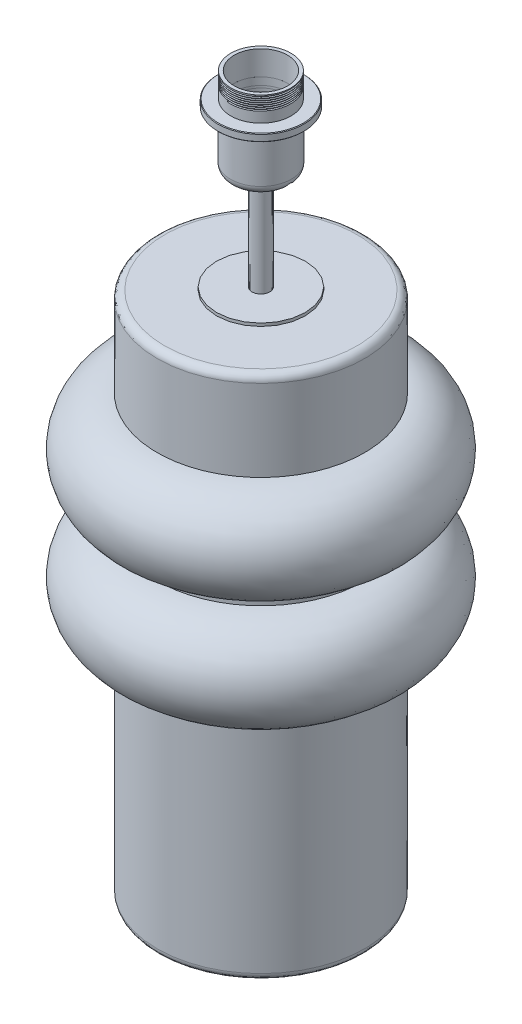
SolidWorks part; units mm, degrees
ref_plane "Alzado" through (0, 0, 0) normal (0, 0, 1) x (1, 0, 0)
ref_plane "Planta" through (0, 0, 0) normal (0, 1, 0) x (1, 0, 0)
ref_plane "Vista lateral" through (0, 0, 0) normal (1, 0, 0) x (0, 0, -1)
sketch "Croquis1" plane through (0, 0, 0) normal (0, 1, 0) x (1, 0, 0)
  circle A0 centre (0, 0) radius 70
extrude "Saliente-Extruir1" add sketch "Croquis1" along normal blind 355
fillet "Redondeo1" radius 5 2 edges at (0, 0, 70) (0, 355, 70)
sketch "Croquis2" plane through (0, 355, 0) normal (0, 1, 0) x (1, 0, 0)
  circle A0 centre (0, 0) radius 30
extrude "Saliente-Extruir2" add sketch "Croquis2" along normal blind 2
sketch "Croquis3" plane through (0, 357, 0) normal (0, 1, 0) x (1, 0, 0)
  circle A0 centre (0, 0) radius 6
extrude "Saliente-Extruir3" add sketch "Croquis3" along normal blind 67.15
sketch "Croquis4" plane through (0, 0, 0) normal (0, 0, 1) x (1, 0, 0)
  line L0 (-65, 0) -> (-70, 0)
  line L1 (-70, 295.02) -> (-70, 230.02)
  line L2 (-70, 350) -> (-70, 5) construction
  line L3 (-70, 220.02) -> (-70, 155.02)
  line L4 (0, 0) -> (0, 338.8915)
  arc A0 (-70, 155.02) -> (-70, 220.02) centre (-70, 187.52) cw
  arc A1 (-70, 230.02) -> (-70, 295.02) centre (-70, 262.52) cw
  dimension "D1" = 32.5
  dimension "D2" = 32.5
revolve "Revolución1" add sketch "Croquis4" angle 360 about L4
sketch "Croquis5" plane through (0, 424.15, 0) normal (0, 1, 0) x (1, 0, 0)
  circle A0 centre (0, 0) radius 20.5
  dimension "D1" = 41
extrude "Saliente-Extruir4" add sketch "Croquis5" along normal blind 34.4 separate body
fillet "Redondeo2" radius 6 1 edges at (0, 424.15, 20.5)
sketch "Croquis6" plane through (0, 458.55, 0) normal (0, 1, 0) x (1, 0, 0)
  circle A0 centre (0, 0) radius 22.25
  dimension "D1" = 44.5
extrude "Saliente-Extruir5" add sketch "Croquis6" along normal blind 1.95 contours A0
sketch "Croquis7" plane through (0, 460.5, 0) normal (0, 1, 0) x (1, 0, 0)
  circle A0 centre (0, 0) radius 20.5
extrude "Saliente-Extruir6" add sketch "Croquis7" along normal blind 1.5
sketch "Croquis9" plane through (0, 462, 0) normal (0, 1, 0) x (1, 0, 0)
  circle A0 centre (0, 0) radius 29
extrude "Saliente-Extruir7" add sketch "Croquis9" along normal blind 5
chamfer "Chaflán1" distance 0.42 angle 45 2 edges at (0, 462, 29) (0, 467, 29)
sketch "Croquis10" plane through (0, 467, 0) normal (0, 1, 0) x (1, 0, 0)
  circle A0 centre (0, 0) radius 20.3
extrude "Saliente-Extruir8" add sketch "Croquis10" along normal blind 16.46
thread "Rosca1" pitch 1.25 start angle 0, offset 0, length 8.46, pitch 1.25, diameter 40.6
ref_plane "Plano1" through (-20.3, 483.46, 0) normal (0, 0, 1) x (-1, 0, 0)
sketch "Perfil de rosca1" plane through (-20.3, 483.46, 0) normal (0, 0, 1) x (-1, 0, 0)
  line L0 (0, 0) -> (0, 1.25) construction
  line L11 (0, 0) -> (0, 1.0937)
  line L12 (0, 1.0937) -> (-0.6766, 0.7031)
  line L13 (-0.6766, 0.7031) -> (-0.6766, 0.3906)
  line L15 (-0.6766, 0.3906) -> (0, 0)
  line L17 (-0.6766, 0.5469) -> (0, 0.5469) construction
  point P2 (0, 0)
  dimension "Pitch" = 1.25
  dimension "Profile_Angle" = 60
  dimension "Profile_Land" = 0.3125
  dimension "Profile_Height" = 0.6766
sketch "Croquis13" plane through (0, 424.15, 0) normal (0, -1, 0) x (1, 0, 0)
  line L0 (-17, 0) -> (17, 0)
  circle A0 centre (17, 0) radius 3
  circle A1 centre (-17, 0) radius 3
  point P4 (0, 0)
  dimension "D1" = 34
extrude "Cortar-Extruir1" cut sketch "Croquis13" against normal blind 8 contours A0 | A1
sketch "Croquis14" plane through (0, 483.46, 0) normal (0, 1, 0) x (1, 0, 0)
  circle A0 centre (0, 0) radius 18
extrude "Cortar-Extruir2" cut sketch "Croquis14" against normal blind 46
sketch "Croquis15" plane through (0, 0, 0) normal (1, 0, 0) x (0, 0, -1)
  line L0 (0, 0) -> (0, 615.3346)
  line L2 (-200, 431.8) -> (-200, 654.3)
  line L5 (-199, 433.0247) -> (-199, 653.0753)
  arc A0 (-199, 653.0753) -> (-200, 654.3) centre (-198.75, 654.3) ccw
  arc A1 (-200, 431.8) -> (-199, 433.0247) centre (-198.75, 431.8) ccw
  point P18 (-199, 543.05)
